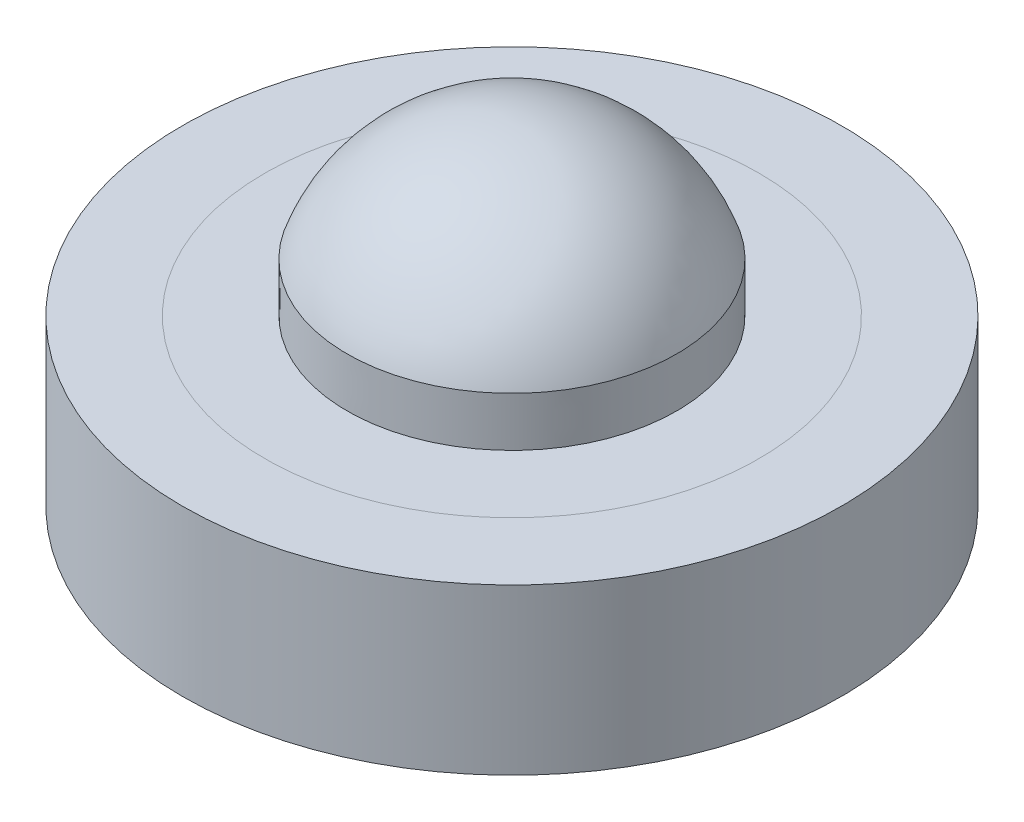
SolidWorks part; units mm, degrees
ref_plane "Front Plane" through (0, 0, 0) normal (0, 0, 1) x (1, 0, 0)
ref_plane "Top Plane" through (0, 0, 0) normal (0, 1, 0) x (1, 0, 0)
ref_plane "Right Plane" through (0, 0, 0) normal (1, 0, 0) x (0, 0, -1)
sketch "Sketch1" plane through (0, 0, 0) normal (0, 0, 1) x (1, 0, 0)
  line L0 (14.8295, 3) -> (14.8278, 0)
  line L1 (14.8278, 0) -> (19.8278, 0)
  line L2 (4.8278, 0) -> (4.8278, 13) construction
  line L4 (18.8278, 3) -> (17.8278, 3)
  line L6 (4.8278, 10.13) -> (4.8278, 13)
  line L8 (18.8278, 3) -> (19.8278, 0)
  line L12 (7.6978, 2.87) -> (14.8278, 2.87) construction
  line L13 (14.8278, 2.87) -> (14.8734, 2.87) construction
  line L14 (14.8734, 2.87) -> (14.8734, 2.87) construction
  line L15 (14.8734, 2.87) -> (14.8734, 2.87) construction
  line L16 (7.6978, 2.87) -> (7.6978, 9.7333) construction
  line L17 (4.8278, 0) -> (14.8278, 0) construction
  arc A0 (4.8278, 13) -> (17.8278, 3) centre (4.8278, -0.45) cw
  arc A1 (4.8278, 10.13) -> (14.8295, 3) centre (4.8278, -0.45) cw
  arc A2 (7.6978, 9.7333) -> (14.8734, 2.87) centre (4.8278, -0.45) cw construction
revolve "Revolve1" add sketch "Sketch1" angle 360 about L6
scale "Scale1" scale about centroid uniform scaling yes scale factor 1
other "Parting Line1"
other "Parting Surface1" parameters "D1"=11.1
sketch "Sketch2" plane through (0, 0, 0) normal (0, 1, 0) x (1, 0, 0)
  line L0 (4.8278, 0) -> (14.8295, 0) construction
  line L1 (4.8278, 0) -> (17.8278, 0) construction
  circle A0 centre (4.8278, 0) radius 20
  dimension "D1" = 40
other "Tooling Split1" parameters "D1"=10, "D2"=20, "D3"=3
move or copy body "Body-Move/Copy5" bodies to move or copy 108 copy no translate (0, -34.4321, 0)
move or copy body "Body-Move/Copy6" bodies to move or copy 103 copy no translate (0, -22.2088, 0)
delete or keep bodies "Body-Delete/Keep 1" type delete bodies bodies 114 107
